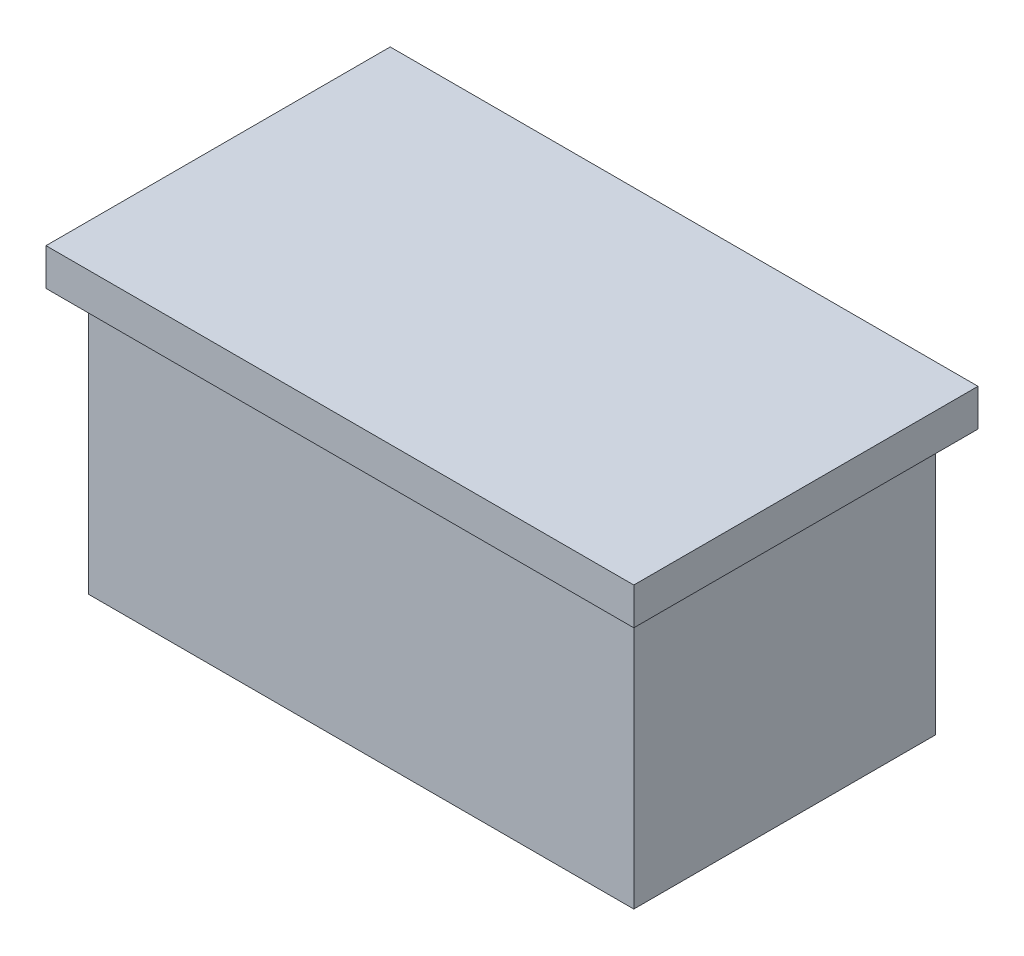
SolidWorks part; units mm, degrees
ref_plane "Front Plane" through (0, 0, 0) normal (0, 0, 1) x (1, 0, 0)
ref_plane "Top Plane" through (0, 0, 0) normal (0, 1, 0) x (1, 0, 0)
ref_plane "Right Plane" through (0, 0, 0) normal (1, 0, 0) x (0, 0, -1)
sketch "Sketch1" plane through (0, 0, 0) normal (0, 1, 0) x (1, 0, 0)
  line L1 (-51.5, -28.5) -> (51.5, -28.5)
  line L2 (-51.5, -28.5) -> (-51.5, 28.5)
  line L3 (-51.5, 28.5) -> (51.5, 28.5)
  line L4 (51.5, -28.5) -> (51.5, 28.5)
  line L5 (-51.5, -28.5) -> (51.5, 28.5) construction
  line L6 (-51.5, 28.5) -> (51.5, -28.5) construction
  point P0 (0, 0)
  dimension "D1" = 103
  dimension "D2" = 57
extrude "Extrude1" add sketch "Sketch1" along normal blind 50
sketch "Sketch2" plane through (0, 50, 0) normal (0, 1, 0) x (1, 0, 0)
  line L1 (-55.5, -32.5) -> (55.5, -32.5)
  line L2 (-55.5, -32.5) -> (-55.5, 32.5)
  line L3 (-55.5, 32.5) -> (55.5, 32.5)
  line L4 (55.5, -32.5) -> (55.5, 32.5)
  line L5 (-55.5, -32.5) -> (55.5, 32.5) construction
  line L6 (-55.5, 32.5) -> (55.5, -32.5) construction
  point P0 (0, 0)
  dimension "D1" = 111
  dimension "D2" = 65
extrude "Extrude2" add sketch "Sketch2" along normal blind 7
